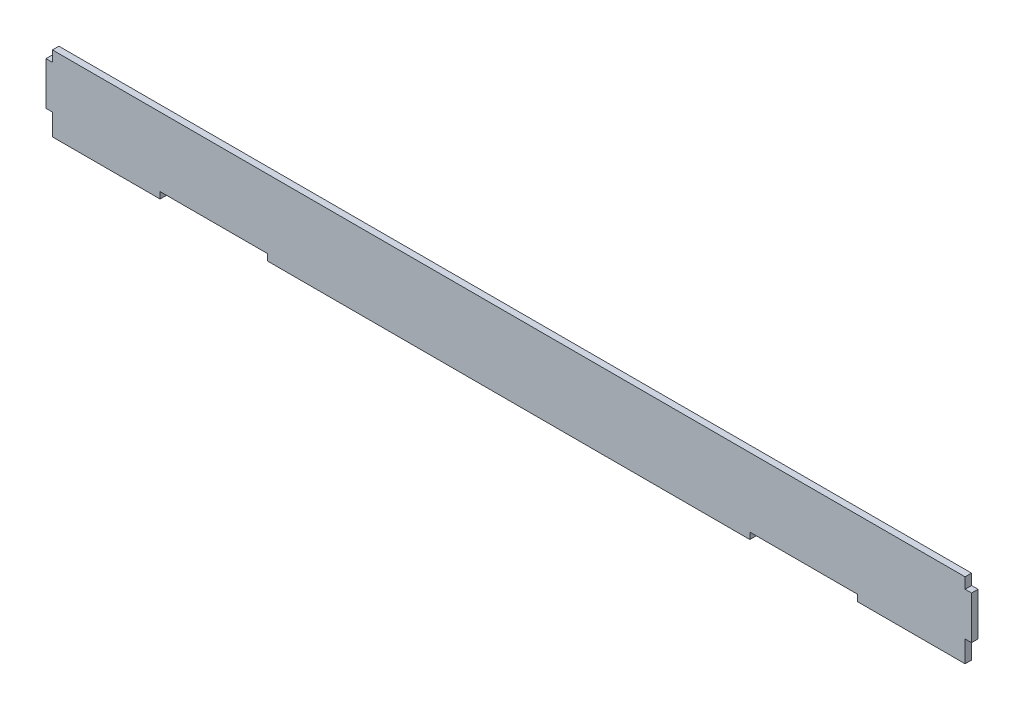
SolidWorks part; units mm, degrees
ref_plane "Front Plane" through (0, 0, 0) normal (0, 0, 1) x (1, 0, 0)
ref_plane "Top Plane" through (0, 0, 0) normal (0, 1, 0) x (1, 0, 0)
ref_plane "Right Plane" through (0, 0, 0) normal (1, 0, 0) x (0, 0, -1)
sketch "Sketch1" plane through (0, 0, 0) normal (0, 0, 1) x (1, 0, 0)
  line L0 (100, 0) -> (324, 0)
  line L1 (0, 0) -> (50, 0)
  line L2 (0, 0) -> (0, 10)
  line L3 (0, 35) -> (424, 35)
  line L4 (424, 0) -> (424, 10)
  line L5 (0, 30) -> (-3, 30)
  line L7 (0, 10) -> (-3, 10)
  line L8 (-3, 30) -> (-3, 10)
  line L9 (424, 30) -> (427, 30)
  line L11 (424, 10) -> (427, 10)
  line L12 (427, 30) -> (427, 10)
  line L14 (50, 0) -> (50, 3)
  line L15 (50, 3) -> (100, 3)
  line L16 (100, 0) -> (100, 3)
  line L18 (324, 0) -> (324, 3)
  line L19 (324, 3) -> (374, 3)
  line L20 (374, 0) -> (374, 3)
  line L21 (374, 0) -> (424, 0)
  line L22 (0, 30) -> (0, 35)
  line L23 (424, 30) -> (424, 35)
  dimension "D1" = 424
  dimension "D2" = 20
  dimension "D3" = 10
  dimension "D4" = 3
  dimension "D5" = 3
  dimension "D6" = 50
  dimension "D7" = 50
  dimension "D8" = 35
  dimension "D9" = 10
  dimension "D10" = 20
  dimension "D11" = 3
  dimension "D12" = 3
  dimension "D13" = 50
  dimension "D14" = 50
extrude "Boss-Extrude1" add sketch "Sketch1" along normal blind 3
